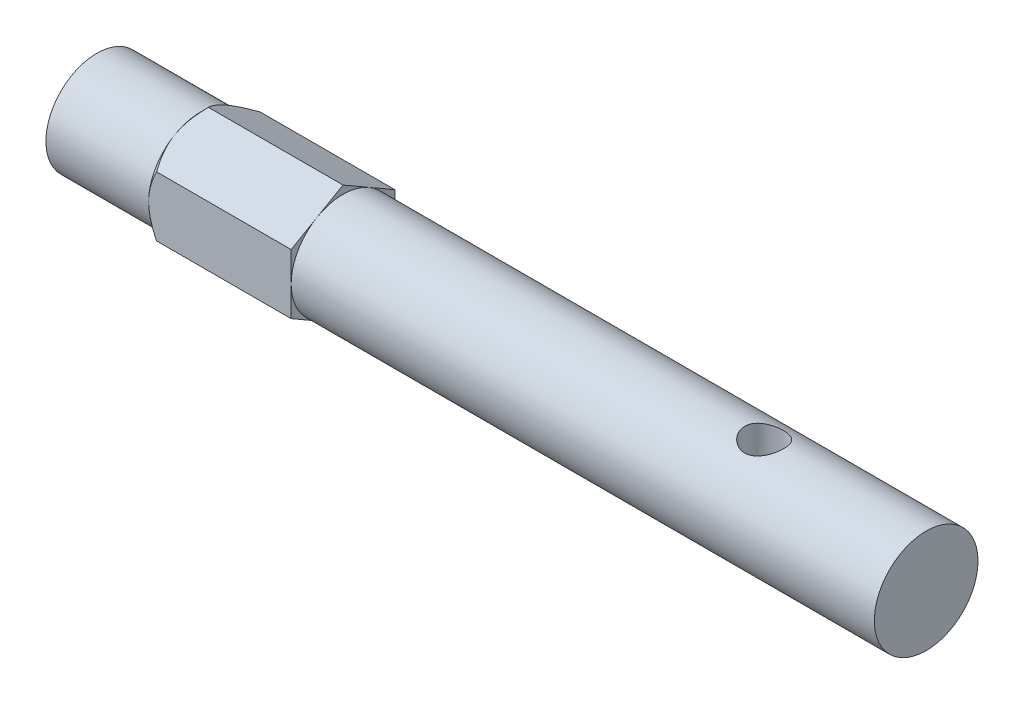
SolidWorks part; units mm, degrees
ref_plane "Plan1" through (0, 0, 0) normal (0, 0, 1) x (1, 0, 0)
ref_plane "Plan2" through (0, 0, 0) normal (0, 1, 0) x (1, 0, 0)
ref_plane "Plan3" through (0, 0, 0) normal (1, 0, 0) x (0, 0, -1)
sketch "Esquisse1" plane through (0, 0, 0) normal (0, 0, 1) x (1, 0, 0)
  line L0 (-8, 3.8664) -> (-3.9013, 1.5)
  line L1 (0, 0) -> (56, 0)
  line L2 (0, 3.925) -> (0, 5)
  line L3 (0, 5) -> (11, 5)
  line L4 (11, 4) -> (11, 5)
  line L5 (-3.9013, 1.5) -> (-0.9013, 1.5)
  line L6 (-0.9013, 1.5) -> (0, 0)
  line L7 (0, 3.925) -> (-8, 3.925)
  line L8 (-8, 3.8664) -> (-8, 3.925)
  line L9 (0, -50) -> (0, 50) construction
  line L11 (0, 0) -> (-31, 0) construction
  line L13 (11, 4) -> (56, 4)
  line L14 (56, 0) -> (56, 4)
  dimension "D1" = 10
  dimension "D2" = 59
  dimension "D3" = 30
  dimension "D4" = 8
  dimension "D5" = 8
  dimension "D6" = 11
  dimension "D7" = 3
  dimension "D8" = 45
  dimension "D9" = 7.85
  dimension "D10" = 8
  dimension "D11" = 3
revolve "Base-Révolution" add sketch "Esquisse1" angle 360 about L11
chamfer "Chanfrein2" distance 1 angle 45
sketch "Esquisse2" plane through (0, 0, 0) normal (-1, 0, 0) x (0, 0, 1)
  line L1 (4, -2.3094) -> (4, 2.3094)
  line L2 (4, 2.3094) -> (0, 4.6188)
  line L3 (0, 4.6188) -> (-4, 2.3094)
  line L4 (-4, 2.3094) -> (-4, -2.3094)
  line L5 (-4, -2.3094) -> (0, -4.6188)
  line L6 (0, -4.6188) -> (4, -2.3094)
  circle A0 centre (0, 0) radius 4 construction
  circle A2 centre (0, 0) radius 5 construction
  circle A3 centre (0, 0) radius 5
  dimension "D1" = 8
extrude "Enlèv. mat.-Extru.1" cut sketch "Esquisse2" against normal through all
sketch "Esquisse3" plane through (0, 0, 0) normal (0, 1, 0) x (1, 0, 0)
  line L0 (1.8222, 0) -> (-0.6444, 0) construction
  line L1 (11, -4) -> (11, -2) construction
  circle A0 centre (43.5, 0) radius 1.5
  dimension "D1" = 3
  dimension "D2" = 32.5
extrude "Enlèv. mat.-Extru.2" cut sketch "Esquisse3" against normal through all and the other way through all
